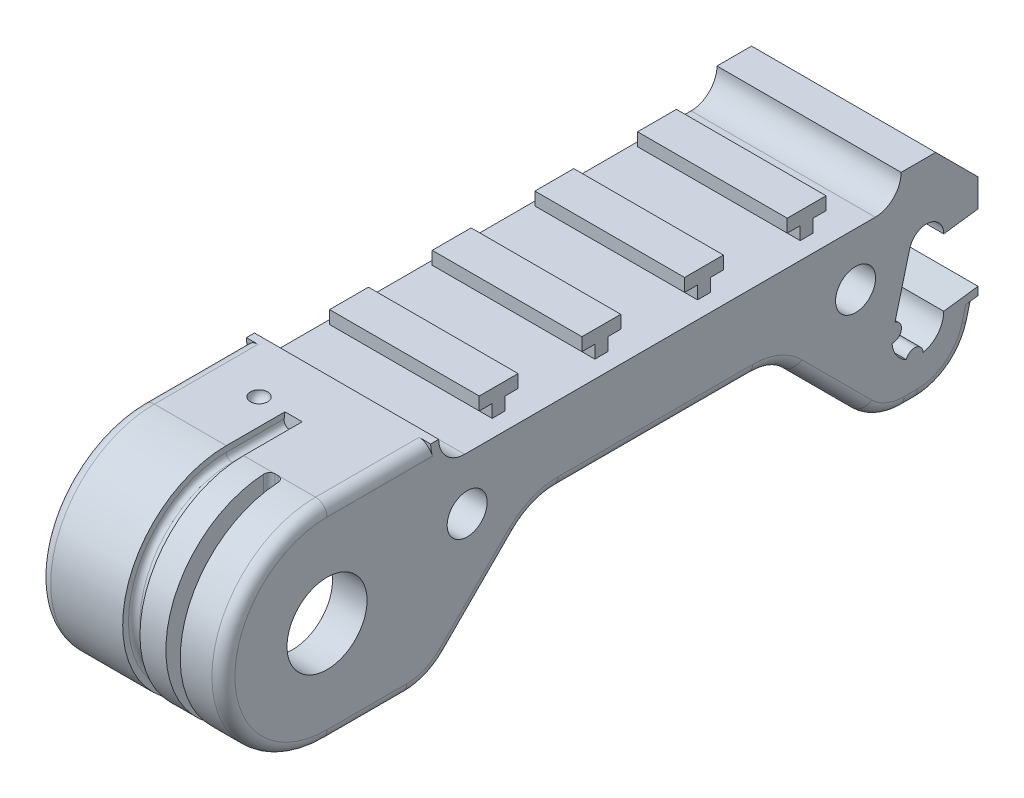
SolidWorks part; units mm, degrees
other "<finger_pivot_print>-<Contouring>"
ref_plane "Front Plane" through (0, 0, 0) normal (0, 0, 1) x (1, 0, 0)
ref_plane "Top Plane" through (0, 0, 0) normal (0, 1, 0) x (1, 0, 0)
ref_plane "Right Plane" through (0, 0, 0) normal (1, 0, 0) x (0, 0, -1)
inserted part "finger_pivot_print"
sketch "Sketch1" plane through (8, 0, 0) normal (1, 0, 0) x (0, 0, -1)
  line L0 (69.5237, -1.9065) -> (70.6122, -1.7632) construction
  line L2 (69.5237, -1.9065) -> (70.4099, -3.3314) construction
  line L3 (76.1405, -5.4653) -> (77.2414, -5.1229) construction
  line L4 (80.1826, -2.6747) -> (83.8419, 4.2878) construction
  line L5 (86.7831, 6.7361) -> (102.0572, 11.486) construction
  line L6 (104.9984, 13.9342) -> (106.3109, 16.4315) construction
  line L29 (95.0443, 22.353) -> (71.9106, 15.1589) construction
  line L30 (69.9697, 11.466) -> (67.7735, 10.783) construction
  line L31 (67.7735, 10.783) -> (66.3939, 8.1581) construction
  line L32 (66.3939, 8.1581) -> (67.3638, 5.0391) construction
  line L33 (67.3638, 5.0391) -> (56.5464, 3.615) construction
  line L34 (56.5464, 3.615) -> (56.5464, 5.3249) construction
  line L35 (56.5464, 5.3249) -> (52.8714, 9) construction
  line L36 (52.8714, 9) -> (50.5714, 9) construction
  line L37 (47.6214, 11.95) -> (11.95, 11.95) construction
  line L38 (55.4757, -3.756) -> (70.6122, -1.7632) construction
  line L39 (9, 9) -> (0, 9) construction
  line L40 (0, -9) -> (6.9289, -9) construction
  line L41 (10.4645, -7.5355) -> (16.5355, -1.4645) construction
  line L42 (20.0711, 0) -> (36.9754, 0) construction
  line L43 (40.5109, -1.4645) -> (46.582, -7.5355) construction
  line L44 (50.1175, -9) -> (51.2765, -9) construction
  line L45 (55.4757, -3.756) -> (56.5464, -3.615) construction
  line L46 (56.113, -5.268) -> (56.5464, -3.615) construction
  line L47 (69.5237, -1.9065) -> (70.6122, -1.7632)
  line L48 (69.5237, -1.9065) -> (70.4099, -3.3314)
  line L49 (76.1405, -5.4653) -> (77.2414, -5.1229)
  line L50 (80.1826, -2.6747) -> (83.8419, 4.2878)
  line L51 (86.7831, 6.7361) -> (102.0572, 11.486)
  line L52 (104.9984, 13.9342) -> (106.3109, 16.4315)
  line L53 (95.0443, 22.353) -> (71.9106, 15.1589)
  line L67 (69.9697, 11.466) -> (67.7735, 10.783)
  line L68 (67.7735, 10.783) -> (66.3939, 8.1581)
  line L69 (66.3939, 8.1581) -> (67.3638, 5.0391)
  line L70 (67.3638, 5.0391) -> (56.5464, 3.615)
  line L71 (56.5464, 3.615) -> (56.5464, 5.3249)
  line L72 (56.5464, 5.3249) -> (52.8714, 9)
  line L73 (52.8714, 9) -> (50.5714, 9)
  line L74 (47.6214, 11.95) -> (11.95, 11.95)
  line L75 (55.4757, -3.756) -> (70.6122, -1.7632)
  line L76 (9, 9) -> (0, 9)
  line L77 (0, -9) -> (6.9289, -9)
  line L78 (10.4645, -7.5355) -> (16.5355, -1.4645)
  line L79 (20.0711, 0) -> (36.9754, 0)
  line L80 (40.5109, -1.4645) -> (46.582, -7.5355)
  line L81 (50.1175, -9) -> (51.2765, -9)
  line L82 (55.4757, -3.756) -> (56.5464, -3.615)
  line L83 (56.113, -5.268) -> (56.5464, -3.615)
  line L84 (9, 9) -> (50.5714, 9)
  line L85 (95.2522, 21.6845) -> (96.5884, 17.3875) construction
  line L86 (69.9697, 11.466) -> (95.9203, 19.536)
  line L87 (95.9203, 19.536) -> (105.4064, 16.8833)
  line L88 (105.4064, 16.8833) -> (106.3109, 16.4315)
  line L89 (56.5464, 3.615) -> (56.5464, -3.615)
  line L90 (67.3638, 5.0391) -> (69.5237, -1.9065)
  arc A4 (70.4099, -3.3314) -> (76.1405, -5.4653) centre (74.6558, -0.6908) ccw construction
  arc A5 (77.2414, -5.1229) -> (80.1826, -2.6747) centre (75.7567, -0.3485) ccw construction
  arc A6 (86.7831, 6.7361) -> (83.8419, 4.2878) centre (88.2679, 1.9616) ccw construction
  arc A21 (102.0572, 11.486) -> (104.9984, 13.9342) centre (100.5725, 16.2604) ccw construction
  arc A22 (106.3109, 16.4315) -> (105.8272, 17.6606) centre (97.7168, 13.7589) ccw construction
  arc A23 (105.8272, 17.6606) -> (95.0443, 22.353) centre (97.7168, 13.7589) ccw construction
  arc A24 (71.9106, 15.1589) -> (69.9697, 11.466) centre (72.7866, 12.342) ccw construction
  arc A25 (50.5714, 9) -> (47.6214, 11.95) centre (47.6214, 9) ccw construction
  arc A26 (11.95, 11.95) -> (9.1747, 8) centre (11.95, 9) ccw construction
  arc A27 (9, 9) -> (9.1747, 8) centre (11.95, 9) ccw construction
  arc A28 (0, 9) -> (0, -9) centre (0, 0) ccw construction
  arc A29 (6.9289, -9) -> (10.4645, -7.5355) centre (6.9289, -4) ccw construction
  arc A30 (20.0711, 0) -> (16.5355, -1.4645) centre (20.0711, -5) ccw construction
  arc A31 (40.5109, -1.4645) -> (36.9754, 0) centre (36.9754, -5) ccw construction
  arc A32 (46.582, -7.5355) -> (50.1175, -9) centre (50.1175, -4) ccw construction
  arc A33 (51.2765, -9) -> (56.113, -5.268) centre (51.2765, -4) ccw construction
  arc A34 (70.4099, -3.3314) -> (76.1405, -5.4653) centre (74.6558, -0.6908) ccw
  arc A35 (77.2414, -5.1229) -> (80.1826, -2.6747) centre (75.7567, -0.3485) ccw
  arc A47 (86.7831, 6.7361) -> (83.8419, 4.2878) centre (88.2679, 1.9616) ccw
  arc A48 (102.0572, 11.486) -> (104.9984, 13.9342) centre (100.5725, 16.2604) ccw
  arc A49 (106.3109, 16.4315) -> (105.8272, 17.6606) centre (97.7168, 13.7589) ccw
  arc A50 (105.8272, 17.6606) -> (95.0443, 22.353) centre (97.7168, 13.7589) ccw
  arc A51 (71.9106, 15.1589) -> (69.9697, 11.466) centre (72.7866, 12.342) ccw
  arc A52 (50.5714, 9) -> (47.6214, 11.95) centre (47.6214, 9) ccw
  arc A53 (11.95, 11.95) -> (9.1747, 8) centre (11.95, 9) ccw
  arc A54 (9, 9) -> (9.1747, 8) centre (11.95, 9) ccw
  arc A55 (0, 9) -> (0, -9) centre (0, 0) ccw
  arc A56 (6.9289, -9) -> (10.4645, -7.5355) centre (6.9289, -4) ccw
  arc A57 (20.0711, 0) -> (16.5355, -1.4645) centre (20.0711, -5) ccw
  arc A58 (40.5109, -1.4645) -> (36.9754, 0) centre (36.9754, -5) ccw
  arc A59 (46.582, -7.5355) -> (50.1175, -9) centre (50.1175, -4) ccw
  arc A60 (51.2765, -9) -> (56.113, -5.268) centre (51.2765, -4) ccw
extrude "Piece Cut" cut sketch "Sketch1" against normal through all
ref_point "Ref Center"
